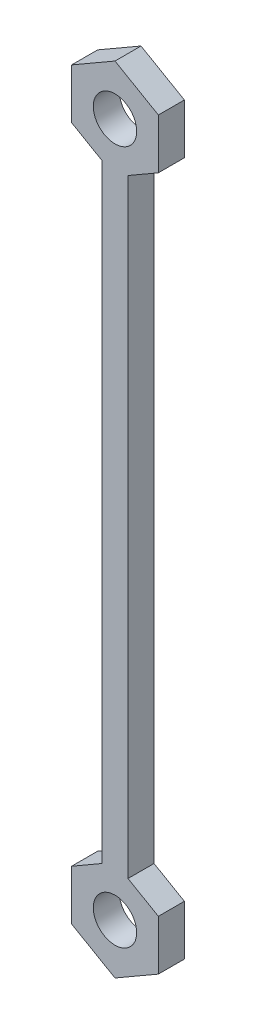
SolidWorks part; units mm, degrees
ref_plane "Alzado" through (0, 0, 0) normal (0, 0, 1) x (1, 0, 0)
ref_plane "Planta" through (0, 0, 0) normal (0, 1, 0) x (1, 0, 0)
ref_plane "Vista lateral" through (0, 0, 0) normal (1, 0, 0) x (0, 0, -1)
sketch "Croquis1" plane through (0, 0, 0) normal (0, 0, 1) x (1, 0, 0)
  line L0 (0, -40) -> (0, 40) construction
  line L1 (-5, 37.1132) -> (-1.5, 35.0925)
  line L2 (0, 34.2265) -> (5, 37.1132) construction
  line L3 (5, 37.1132) -> (5, 42.8868)
  line L4 (5, 42.8868) -> (0, 45.7735)
  line L5 (0, 45.7735) -> (-5, 42.8868)
  line L6 (-5, 42.8868) -> (-5, 37.1132)
  line L7 (-5, 37.1132) -> (0, 34.2265) construction
  line L8 (5, 37.1132) -> (1.5, 35.0925)
  line L9 (0, 0) -> (50000, 0) construction
  line L10 (-5, -37.1132) -> (0, -34.2265) construction
  line L11 (0, -34.2265) -> (5, -37.1132) construction
  line L12 (5, -37.1132) -> (1.5, -35.0925)
  line L13 (-5, -42.8868) -> (-5, -37.1132)
  line L14 (0, -45.7735) -> (-5, -42.8868)
  line L15 (5, -42.8868) -> (0, -45.7735)
  line L16 (5, -37.1132) -> (5, -42.8868)
  line L17 (-5, -37.1132) -> (-1.5, -35.0925)
  line L18 (-1.5, 35.0925) -> (-1.5, -35.0925)
  line L19 (1.5, 35.0925) -> (1.5, -35.0925)
  circle A0 centre (0, 40) radius 2.5
  circle A1 centre (0, -40) radius 2.5
  circle A2 centre (0, 40) radius 5 construction
  circle A3 centre (0, -40) radius 5 construction
  circle A4 centre (0, -40) radius 2.5
  point P2 (0, 0)
  dimension "D2" = 5
  dimension "D3" = 10
  dimension "D1" = 80
  dimension "D4" = 3
extrude "Saliente-Extruir1" add sketch "Croquis1" along normal mid plane 3 contours L19 L8 L3 L4 L5 L6 L1 L18 L17 L13 L14 L15 L16 L12 A1 A0
